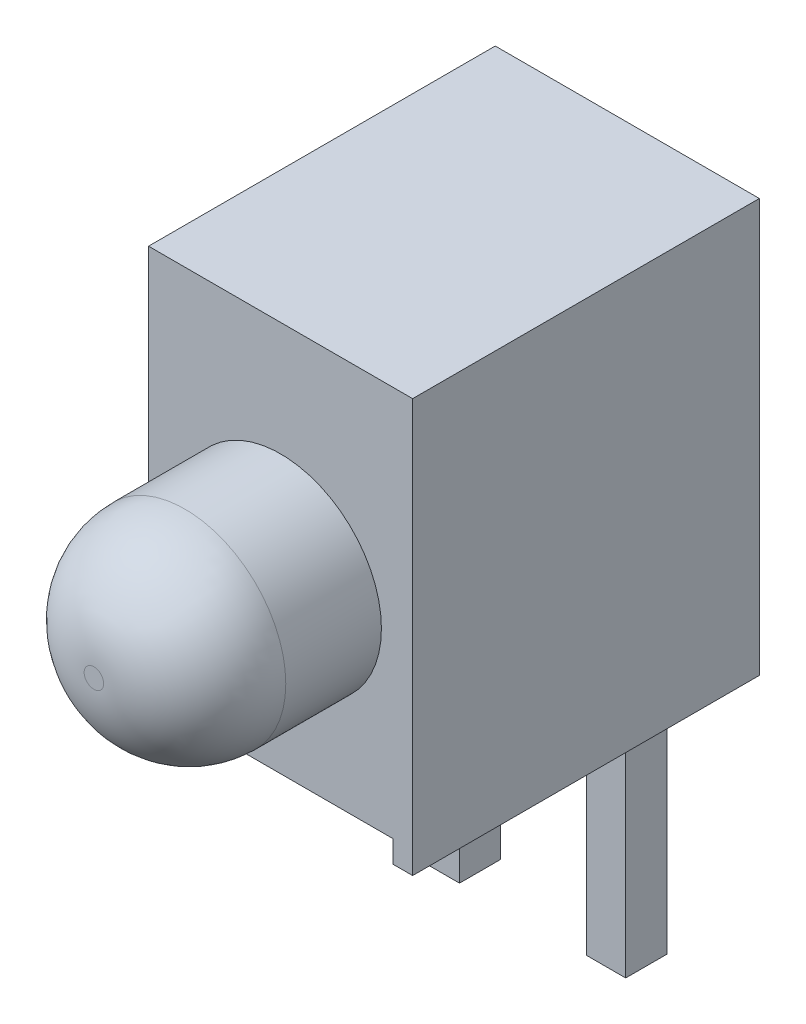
SolidWorks part; units mm, degrees
ref_plane "Front Plane" through (0, 0, 0) normal (0, 0, 1) x (1, 0, 0)
ref_plane "Top Plane" through (0, 0, 0) normal (0, 1, 0) x (1, 0, 0)
ref_plane "Right Plane" through (0, 0, 0) normal (1, 0, 0) x (0, 0, -1)
sketch "Sketch1" plane through (0, 0, 0) normal (0, 1, 0) x (1, 0, 0)
  line L1 (-2.03, 2.665) -> (2.03, 2.665)
  line L2 (-2.03, 2.665) -> (-2.03, -2.665)
  line L3 (-2.03, -2.665) -> (2.03, -2.665)
  line L4 (2.03, 2.665) -> (2.03, -2.665)
  line L5 (-2.03, 2.665) -> (2.03, -2.665) construction
  line L6 (-2.03, -2.665) -> (2.03, 2.665) construction
  point P0 (0, 0)
  dimension "D1" = 4.06
  dimension "D2" = 5.33
extrude "Boss-Extrude1" add sketch "Sketch1" along normal blind 6.35
sketch "Sketch2" plane through (0, 0, 2.665) normal (0, 0, 1) x (1, 0, 0)
  line L0 (-2.03, 0) -> (2.03, 0) construction
  circle A0 centre (0, 3.05) radius 1.55
  dimension "D2" = 3.1
  dimension "D3" = 3.05
extrude "Boss-Extrude2" add sketch "Sketch2" along normal blind 2.8702
fillet "Fillet2" radius 1.4 1 edges at (1.55, 3.05, 5.5352)
sketch "Sketch4" plane through (0, 0, 2.665) normal (0, 0, 1) x (1, 0, 0)
  line L0 (-2.03, 0) -> (2.03, 0) construction
  line L1 (-1.7627, 0) -> (1.7312, 0)
  line L2 (-1.7627, 0) -> (-1.7627, 0.3407)
  line L3 (-1.7627, 0.3407) -> (1.7312, 0.3407)
  line L4 (1.7312, 0) -> (1.7312, 0.3407)
extrude "Cut-Extrude1" cut sketch "Sketch4" against normal through all
sketch "Sketch6" plane through (0, 0.3407, 0) normal (0, -1, 0) x (1, 0, 0)
  line L0 (1.7312, 2.665) -> (2.03, 2.665) construction
  line L1 (-1.5782, -1.0636) -> (-0.9782, -1.0636)
  line L2 (-1.5782, -1.0636) -> (-1.5782, -1.6964)
  line L3 (-1.5782, -1.6964) -> (-0.9782, -1.6964)
  line L4 (-0.9782, -1.0636) -> (-0.9782, -1.6964)
  line L5 (-1.5782, -1.0636) -> (-0.9782, -1.6964) construction
  line L6 (-1.5782, -1.6964) -> (-0.9782, -1.0636) construction
  line L7 (0.9618, -1.0786) -> (1.5618, -1.0786)
  line L8 (0.9618, -1.0786) -> (0.9618, -1.7114)
  line L9 (0.9618, -1.7114) -> (1.5618, -1.7114)
  line L10 (1.5618, -1.0786) -> (1.5618, -1.7114)
  line L11 (0.9618, -1.0786) -> (1.5618, -1.7114) construction
  line L12 (0.9618, -1.7114) -> (1.5618, -1.0786) construction
  line L13 (0, 0) -> (-0.0157, -2.665) construction
  line L14 (1.7312, -2.665) -> (-1.7627, -2.665) construction
  point P0 (-1.2782, -1.38)
  point P5 (1.2618, -1.395)
  dimension "D1" = 4.06
  dimension "D2" = 2.54
  dimension "D3" = 0.6
  dimension "D4" = 0.6
extrude "Boss-Extrude5" add sketch "Sketch6" along normal blind 3.81
